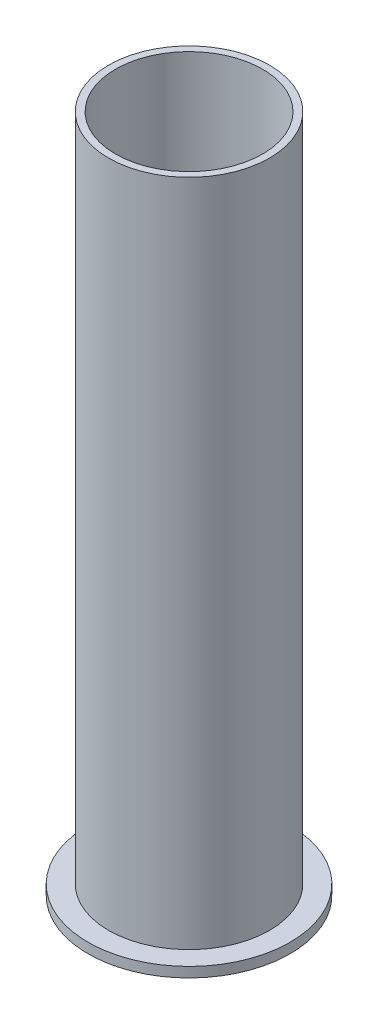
SolidWorks part; units mm, degrees
ref_plane "Front Plane" through (0, 0, 0) normal (0, 0, 1) x (1, 0, 0)
ref_plane "Top Plane" through (0, 0, 0) normal (0, 1, 0) x (1, 0, 0)
ref_plane "Right Plane" through (0, 0, 0) normal (1, 0, 0) x (0, 0, -1)
sketch "Sketch1" plane through (0, 0, 0) normal (0, 1, 0) x (1, 0, 0)
  circle A0 centre (0, 0) radius 5.7785
  circle A1 centre (0, 0) radius 6.3246
  dimension "D1" = 11.557
  dimension "D2" = 12.6492
extrude "Boss-Extrude1" add sketch "Sketch1" along normal blind 53.34
sketch "Sketch2" plane through (0, 0, 0) normal (0, -1, 0) x (1, 0, 0)
  circle A0 centre (0, 0) radius 5.7785 construction
  circle A1 centre (0, 0) radius 5.7785
  circle A2 centre (0, 0) radius 7.9375
  dimension "D1" = 15.875
extrude "Boss-Extrude2" add sketch "Sketch2" against normal blind 0.7874
